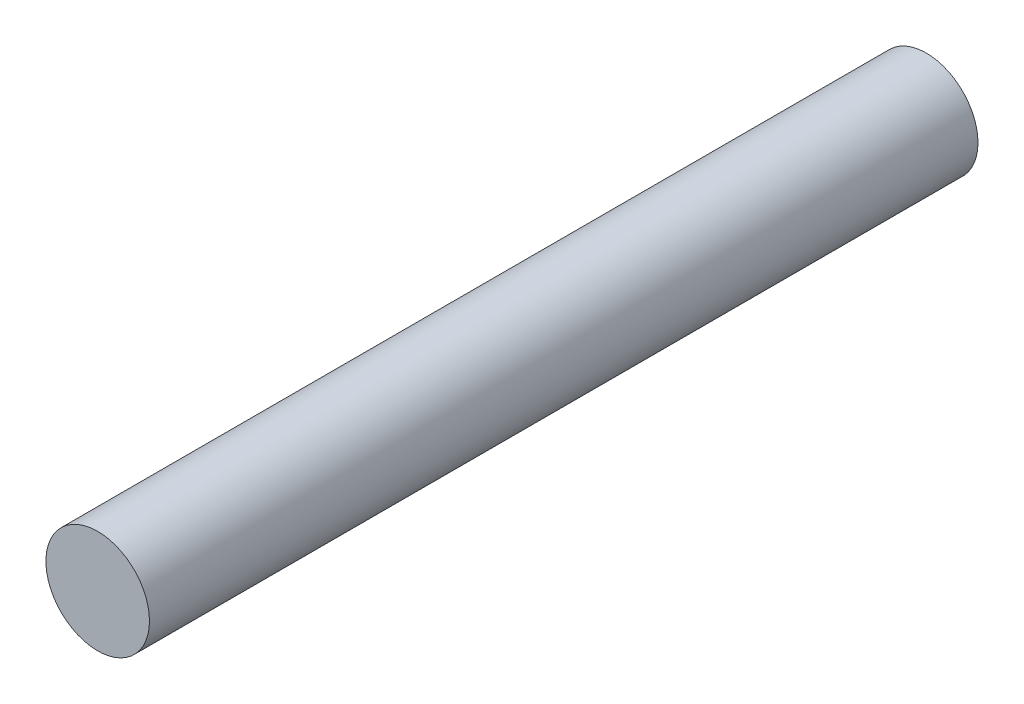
SolidWorks part; units mm, degrees
ref_plane "Ebene vorne" through (0, 0, 0) normal (0, 0, 1) x (1, 0, 0)
ref_plane "Ebene oben" through (0, 0, 0) normal (0, 1, 0) x (1, 0, 0)
ref_plane "Ebene rechts" through (0, 0, 0) normal (1, 0, 0) x (0, 0, -1)
sketch "Skizze1" plane through (0, 0, 0) normal (0, 0, 1) x (1, 0, 0)
  circle A0 centre (-24.7928, 17.5631) radius 5
  dimension "D1" = 10
extrude "Linear austragen1" add sketch "Skizze1" along normal blind 80
sketch "Skizze2" plane through (0, 0, 0) normal (0, 0, -1) x (-1, 0, 0)
  point P0 (24.7928, 17.5631)
